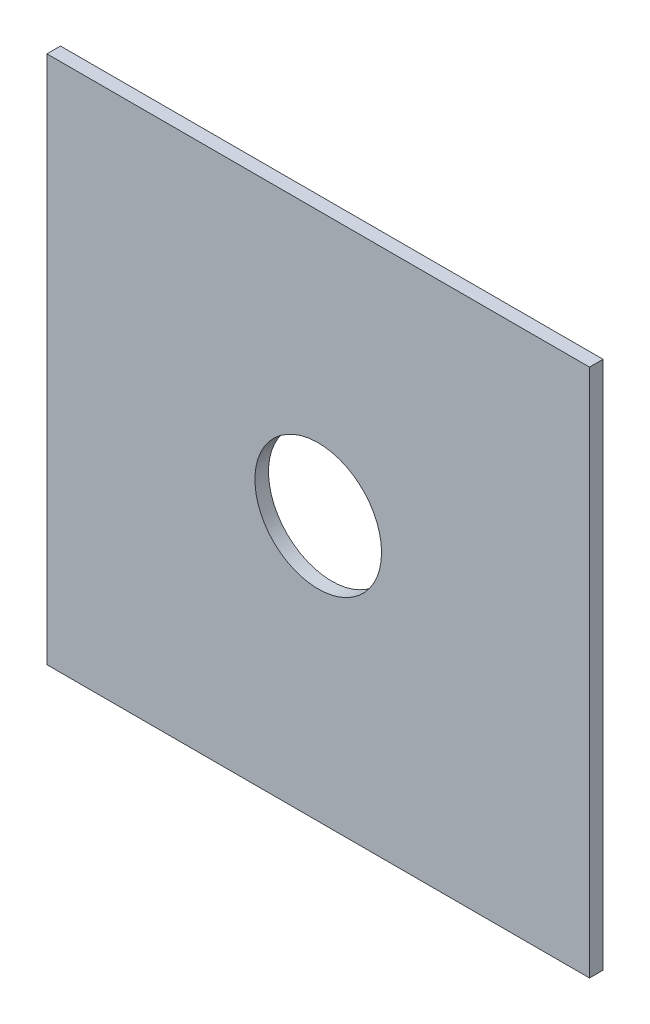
SolidWorks part; units mm, degrees
ref_plane "Alzado" through (0, 0, 0) normal (0, 0, 1) x (1, 0, 0)
ref_plane "Planta" through (0, 0, 0) normal (0, 1, 0) x (1, 0, 0)
ref_plane "Vista lateral" through (0, 0, 0) normal (1, 0, 0) x (0, 0, -1)
sketch "Croquis1" plane through (0, 0, 0) normal (0, 0, 1) x (1, 0, 0)
  line L1 (-300, 292.5) -> (300, 292.5)
  line L2 (-300, 292.5) -> (-300, -292.5)
  line L3 (-300, -292.5) -> (300, -292.5)
  line L4 (300, 292.5) -> (300, -292.5)
  line L5 (-300, 292.5) -> (300, -292.5) construction
  line L6 (-300, -292.5) -> (300, 292.5) construction
  point P0 (0, 0)
  dimension "D1" = 600
  dimension "D2" = 585
extrude "Saliente-Extruir1" add sketch "Croquis1" along normal blind 15
sketch "Croquis2" plane through (0, 0, 15) normal (0, 0, 1) x (1, 0, 0)
  circle A0 centre (0, 0) radius 70
  dimension "D1" = 140
extrude "Cortar-Extruir1" cut sketch "Croquis2" against normal blind 15
